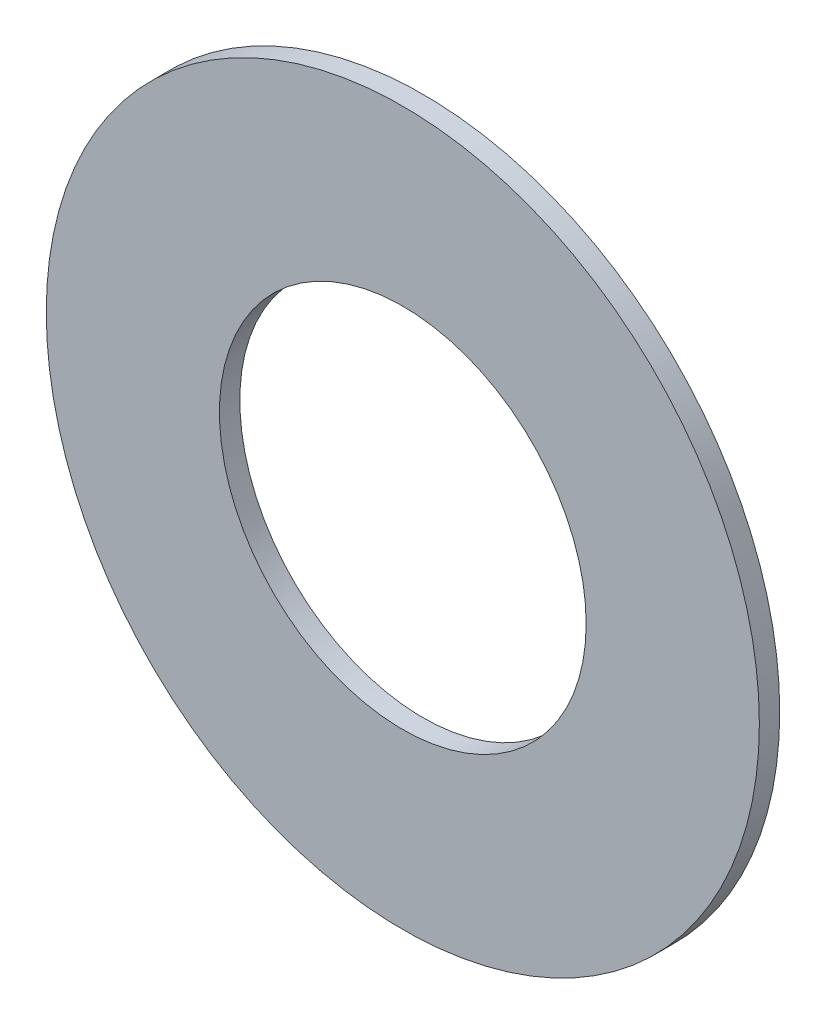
SolidWorks part; units mm, degrees
ref_plane "Front Plane" through (0, 0, 0) normal (0, 0, 1) x (1, 0, 0)
ref_plane "Top Plane" through (0, 0, 0) normal (0, 1, 0) x (1, 0, 0)
ref_plane "Right Plane" through (0, 0, 0) normal (1, 0, 0) x (0, 0, -1)
sketch "Sketch1" plane through (0, 0, 0) normal (0, 0, 1) x (1, 0, 0)
  circle A0 centre (0, 0) radius 18
  circle A1 centre (0, 0) radius 35
extrude "Extrude1" add sketch "Sketch1" along normal blind 2
